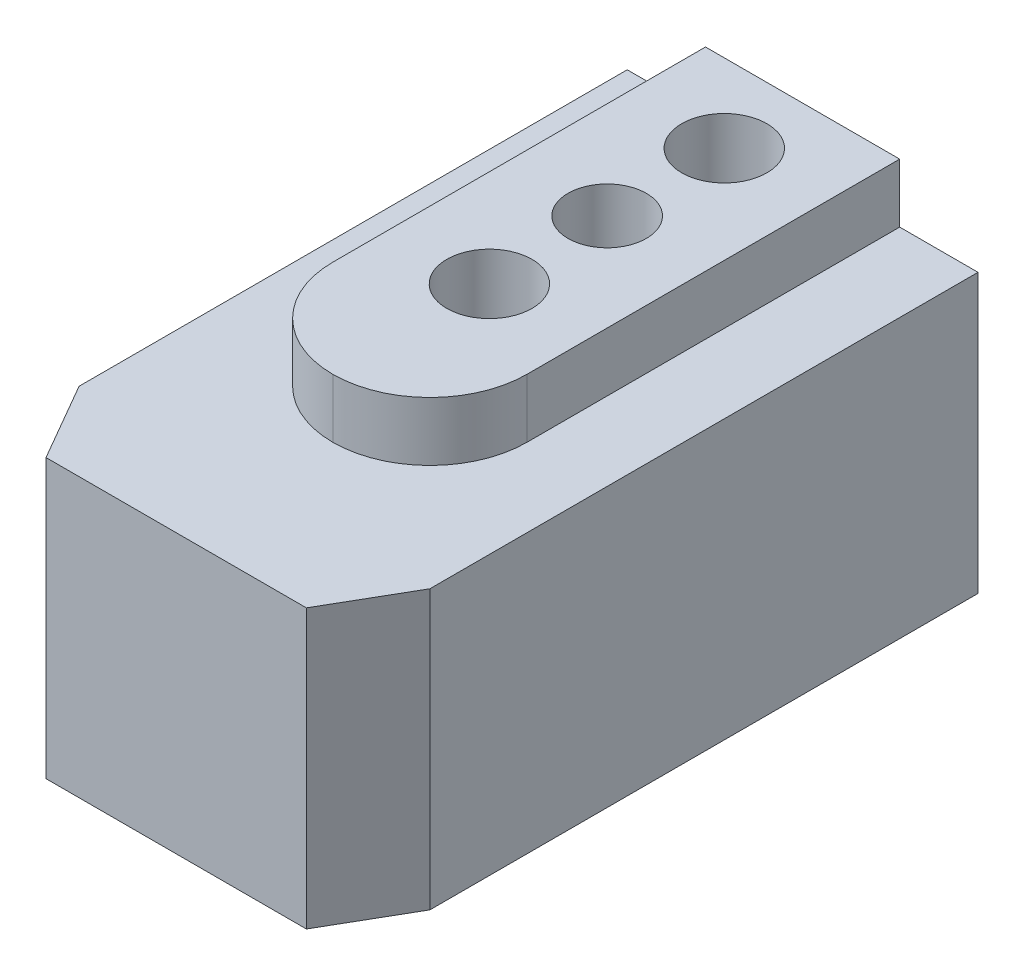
SolidWorks part; units mm, degrees
ref_plane "Front/Back" through (0, 0, 0) normal (0, 0, 1) x (1, 0, 0)
ref_plane "Top/Bottom" through (0, 0, 0) normal (0, 1, 0) x (1, 0, 0)
ref_plane "Right/Left" through (0, 0, 0) normal (1, 0, 0) x (0, 0, -1)
sketch "Sketch1" plane through (0, 0, 0) normal (0, 1, 0) x (1, 0, 0)
  line L0 (0, 0) -> (7.112, 0) construction
  line L1 (-7.112, 12.7) -> (7.112, 12.7)
  line L2 (-7.112, 12.7) -> (-7.112, -12.7)
  line L3 (-7.112, -12.7) -> (7.112, -12.7)
  line L4 (7.112, 12.7) -> (7.112, -12.7)
  line L5 (0, 0) -> (0, 12.7) construction
  dimension "D1" = 14.224
  dimension "D2" = 25.4
extrude "Extrude1" add sketch "Sketch1" along normal mid plane 11.2776
sketch "Sketch2" plane through (0, 5.6388, 0) normal (0, 1, 0) x (-1, 0, 0)
  line L0 (-7.112, -12.7) -> (7.112, -12.7) construction
  line L1 (-3.937, -12.7) -> (3.937, -12.7)
  line L2 (-3.937, -12.7) -> (-3.937, 6.35)
  line L3 (-3.937, 6.35) -> (3.937, 6.35)
  line L4 (3.937, -12.7) -> (3.937, 6.35)
  line L5 (0, 0) -> (0, 13.6166) construction
  line L6 (0, 0) -> (8.6765, 0) construction
  dimension "D1" = 19.05
  dimension "D2" = 7.874
extrude "Extrude2" add sketch "Sketch2" along normal blind 2.3876
fillet "Fillet1" radius 3.937 2 edges at (-3.937, 6.8326, 6.35) (3.937, 6.8326, 6.35)
chamfer "Chamfer2" distance 3.175 angle 30 1 edges at (7.112, 0, 12.7)
chamfer "Chamfer3" distance 3.175 angle 30 1 edges at (-7.112, 0, 12.7)
hole_wizard "#8-32 (Finger Mount Holes)" positions "Sketch4" profile "Sketch3" tap size "#8-32" standard "ANSI Inch"
sketch "Sketch4" plane through (0, 8.0264, 0) normal (0, 1, 0) x (-1, 0, 0)
  line L0 (0, 0) -> (9.3919, 0) construction
  line L1 (0, 0) -> (0, 13.5532) construction
  line L2 (-3.937, -12.7) -> (3.937, -12.7) construction
  point P0 (0, 0)
  point P1 (0, -9.525)
  dimension "D1" = 3.175
  dimension "D2" = 9.525
sketch "Sketch3" plane through (0, 8.0264, 0) normal (1, 0, 0) x (0, 0, 1)
  line L0 (0, 0) -> (0, 13.3314)
  line L1 (0, 13.3314) -> (1.7272, 12.2936)
  line L2 (1.7272, 12.2936) -> (1.7272, 0)
  line L5 (1.7272, 0) -> (0, 0)
  line L10 (0, 13.3314) -> (-1.7272, 12.2936) construction
  line L11 (0, -6.35) -> (0, 107.95) construction
  dimension "Tap Drill Dia." = 3.4544
  dimension "Tap Drill Depth" = 12.2936
  dimension "Drill Angle" = 118
sketch "Sketch5" plane through (0, 8.0264, 0) normal (0, 1, 0) x (-1, 0, 0)
  line L0 (0, 0) -> (0, -13.5997) construction
  line L1 (0, 0) -> (9.4849, 0) construction
  line L2 (3.937, -12.7) -> (7.112, -12.7) construction
  circle A0 centre (0, -4.7752) radius 1.5875
  dimension "D1" = 3.175
  dimension "D2" = 7.9248
extrude "(1/8 Dowel Hole - Slip Fit)" cut sketch "Sketch5" against normal blind 6.35
hole_wizard "#8-32 (Finger Mount Holes )" positions "Sketch8" profile "Sketch7" tap size "#8-32" standard "Ansi Inch"
sketch "Sketch8" plane through (0, 0, -12.7) normal (0, 0, -1) x (-1, 0, 0)
  line L0 (0, 0) -> (9.3053, 0) construction
  line L1 (0, 0) -> (0, 8.4854) construction
  line L2 (0, -4.2672) -> (0, 8.0264) construction
  line L3 (-7.112, -5.6388) -> (7.112, -5.6388) construction
  point P0 (-4.445, 2.3114)
  point P1 (4.445, 2.3114)
  dimension "D1" = 8.89
  dimension "D2" = 7.9502
sketch "Sketch7" plane through (4.445, 2.3114, -12.7) normal (1, 0, 0) x (0, 1, 0)
  line L0 (0, 0) -> (0, 13.3318)
  line L1 (0, 13.3318) -> (1.7272, 12.294)
  line L2 (1.7272, 12.294) -> (1.7272, 0)
  line L5 (1.7272, 0) -> (0, 0)
  line L10 (0, 13.3318) -> (-1.7272, 12.294) construction
  line L11 (0, -6.35) -> (0, 107.95) construction
  dimension "Tap Drill Dia." = 3.4544
  dimension "Tap Drill Depth" = 12.294
  dimension "Drill Angle" = 118
sketch "Sketch9" plane through (0, 0, -12.7) normal (0, 0, -1) x (-1, 0, 0)
  line L0 (0, 0) -> (9.1051, 0) construction
  line L1 (0, 0) -> (0, 8.4354) construction
  line L2 (0, -4.2672) -> (0, 8.0264) construction
  line L3 (-7.112, -5.6388) -> (7.112, -5.6388) construction
  circle A0 centre (-4.445, -2.4638) radius 1.1913
  circle A1 centre (4.445, -2.4638) radius 1.1913
  dimension "D1" = 2.3825
  dimension "D2" = 8.89
  dimension "D3" = 3.175
extrude "(3/32 Dowel Holes - Slip Fit)" cut sketch "Sketch9" against normal blind 6.35
